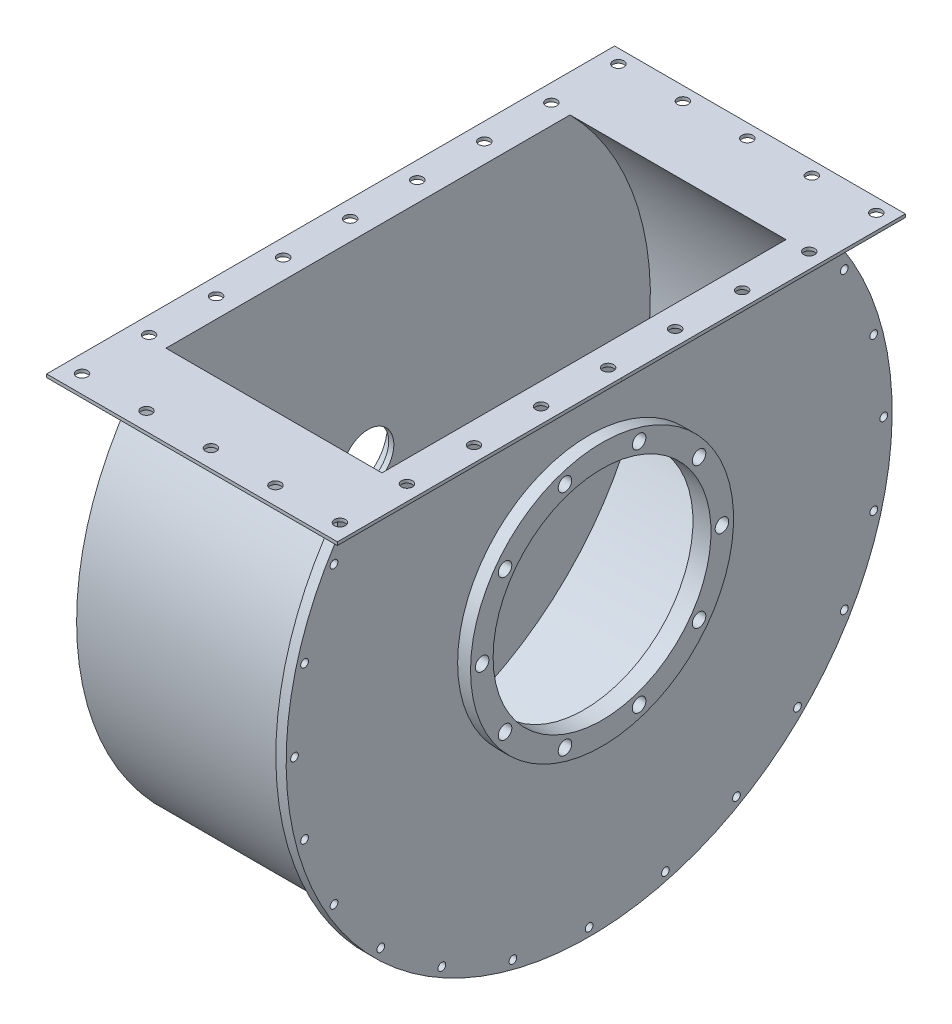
SolidWorks part; units mm, degrees
ref_plane "Front Plane" through (0, 0, 0) normal (0, 0, 1) x (1, 0, 0)
ref_plane "Top Plane" through (0, 0, 0) normal (0, 1, 0) x (1, 0, 0)
ref_plane "Right Plane" through (0, 0, 0) normal (1, 0, 0) x (0, 0, -1)
sketch "Sketch1" plane through (0, 0, 0) normal (0, 0, 1) x (1, 0, 0)
  line L0 (171.5, -204) -> (171.5, -470)
  line L1 (171.5, -470) -> (163.5, -470)
  line L2 (163.5, -470) -> (163.5, -444)
  line L3 (163.5, -444) -> (-179.5, -444)
  line L6 (-179.5, -444) -> (-179.5, -40)
  line L7 (-171.5, -438) -> (-171.5, -40)
  line L8 (-163.5, 0) -> (163.5, 0) construction
  line L9 (-171.5, -438) -> (163.5, -438)
  line L10 (163.5, -438) -> (163.5, -169)
  line L12 (-179.5, -40) -> (-171.5, -40)
  line L13 (171.5, -204) -> (191.5, -204)
  line L14 (191.5, -204) -> (191.5, -169)
  line L15 (163.5, -169) -> (191.5, -169)
  point P5 (0, 0)
  dimension "D7" = 6
  dimension "D2" = 8
  dimension "D3" = 8
  dimension "D4" = 40
  dimension "D5" = 351
  dimension "D6" = 470
  dimension "D8" = 8
  dimension "D9" = 169
  dimension "D10" = 204
  dimension "D11" = 20
  dimension "D12" = 444
  dimension "D13" = 179.5
revolve "Revolve1" add sketch "Sketch1" angle 360 about L8
sketch "Sketch2" plane through (171.5, 0, 0) normal (1, 0, 0) x (0, 0, -1)
  line L0 (385.2635, 306) -> (-385.2635, 306)
  arc A0 (385.2635, 306) -> (-385.2635, 306) centre (0, 0) ccw
  dimension "D1" = 306
extrude "Cut-Extrude1" cut sketch "Sketch2" against normal through all
sketch "Sketch3" plane through (0, 0, 0) normal (0, 0, 1) x (1, 0, 0)
  line L0 (171.5, 256) -> (171.5, 306)
  line L1 (171.5, -470) -> (171.5, 306) construction
  line L2 (171.5, 306) -> (221.5, 306)
  line L3 (221.5, 306) -> (221.5, 301)
  line L4 (221.5, 301) -> (176.5, 301)
  line L5 (176.5, 301) -> (176.5, 256)
  line L6 (176.5, 256) -> (171.5, 256)
  line L7 (0, 0) -> (0, 306) construction
  line L16 (163.5, 306) -> (171.5, 306) construction
  dimension "D1" = 50
  dimension "D2" = 5
sketch "Sketch4" plane through (0, 306, 0) normal (0, 1, 0) x (1, 0, 0)
  line L0 (171.5, 390.5) -> (171.5, -390.5)
  line L1 (171.5, -390.5) -> (-179.5, -390.5)
  line L2 (-179.5, -390.5) -> (-179.5, 390.5)
  line L3 (-179.5, 390.5) -> (171.5, 390.5)
  line L4 (0, 0) -> (171.5, 0) construction
  point P0 (0, 0)
  dimension "D1" = 781
  dimension "D2" = 351
sweep "Sweep2" add profiles "Sketch3" path "Sketch4"
sketch "Sketch7" plane through (0, 306, 0) normal (0, 1, 0) x (1, 0, 0)
  line L0 (-179.5, -321.7142) -> (163.5, -321.7142) construction
  line L1 (-179.5, -390.5) -> (171.5, -390.5)
  line L2 (-179.5, -390.5) -> (-179.5, -321.7142)
  line L3 (-179.5, -321.7142) -> (171.5, -321.7142)
  line L4 (171.5, -390.5) -> (171.5, -321.7142)
  line L5 (171.5, -390.5) -> (171.5, -356.7408) construction
extrude "Boss-Extrude4" add sketch "Sketch7" against normal blind 5
mirror "Mirror5" about plane through (0, 0, 0) normal (0, 0, 1) of "Boss-Extrude4"
sketch "Sketch8" plane through (0, 306, 0) normal (0, 1, 0) x (1, 0, 0)
  line L0 (0, 0) -> (198.5875, 0) construction
  line L1 (-202.4125, -412.6961) -> (198.5875, -412.6961) construction
  line L2 (-202.4125, -412.6961) -> (-202.4125, 419.3039) construction
  line L3 (-202.4125, 419.3039) -> (198.5875, 419.3039) construction
  line L4 (198.5875, -412.6961) -> (198.5875, 419.3039) construction
  circle A0 centre (-202.4125, -412.6961) radius 8.5
  dimension "D3" = 17
  dimension "D1" = 832
  dimension "D2" = 401
extrude "Cut-Extrude2" cut sketch "Sketch8" against normal blind 5
pattern_linear "LPattern1" count 5 spacing 100 along (1, 0, 0) count 9 spacing 104 along (0, 0, -1) of "Cut-Extrude2"
sketch "Sketch9" plane through (191.5, 0, 0) normal (1, 0, 0) x (0, 0, -1)
  circle A0 centre (0, 0) radius 186 construction
  circle A1 centre (-186, 0) radius 10.5
  dimension "D1" = 372
  dimension "D2" = 21
extrude "Cut-Extrude3" cut sketch "Sketch9" against normal blind 20
pattern_circular "CirPattern1" count 10 over 360 about axis through (0, 0, 0) along (1, 0, 0) of "Cut-Extrude3"
sketch "Sketch10" plane through (-179.5, 0, 0) normal (-1, 0, 0) x (0, 0, 1)
  circle A0 centre (0, 0) radius 60
  circle A1 centre (0, 0) radius 90
  dimension "D1" = 120
  dimension "D2" = 180
extrude "Boss-Extrude5" add sketch "Sketch10" along normal blind 22
sketch "Sketch11" plane through (-201.5, 0, 0) normal (-1, 0, 0) x (0, 0, 1)
  line L0 (0, 0) -> (0, 75) construction
  circle A0 centre (0, 75) radius 4
  dimension "D1" = 75
  dimension "D2" = 8
extrude "Cut-Extrude4" cut sketch "Sketch11" against normal blind 22
pattern_circular "CirPattern2" count 6 over 360 about axis through (0, 0, 0) along (1, 0, 0) of "Cut-Extrude4"
sketch "Sketch12" plane through (163.5, 0, 0) normal (-1, 0, 0) x (0, 0, 1)
  line L0 (-360.9695, 301) -> (-326.397, 301)
  line L1 (-395.5, 301) -> (395.5, 301) construction
  line L2 (326.397, 301) -> (360.9695, 301)
  arc A0 (-360.9695, 301) -> (360.9695, 301) centre (0, 0) ccw
  arc A1 (-326.397, 301) -> (326.397, 301) centre (0, 0) ccw
  arc A2 (-362.7671, 256) -> (362.7671, 256) centre (0, 0) ccw construction
  arc A3 (-394.1624, 256) -> (394.1624, 256) centre (0, 0) ccw construction
extrude "Boss-Extrude6" add sketch "Sketch12" along normal blind 8
sketch "Sketch13" plane through (171.5, 0, 0) normal (1, 0, 0) x (0, 0, -1)
  line L0 (0, 0) -> (0, -457) construction
  circle A0 centre (0, -457) radius 6
  dimension "D2" = 12
  dimension "D1" = 457
extrude "Cut-Extrude5" cut sketch "Sketch13" against normal through all
pattern_circular "CirPattern3" count 24 every 15 about axis through (0, 0, 0) along (1, 0, 0) of "Cut-Extrude5"
